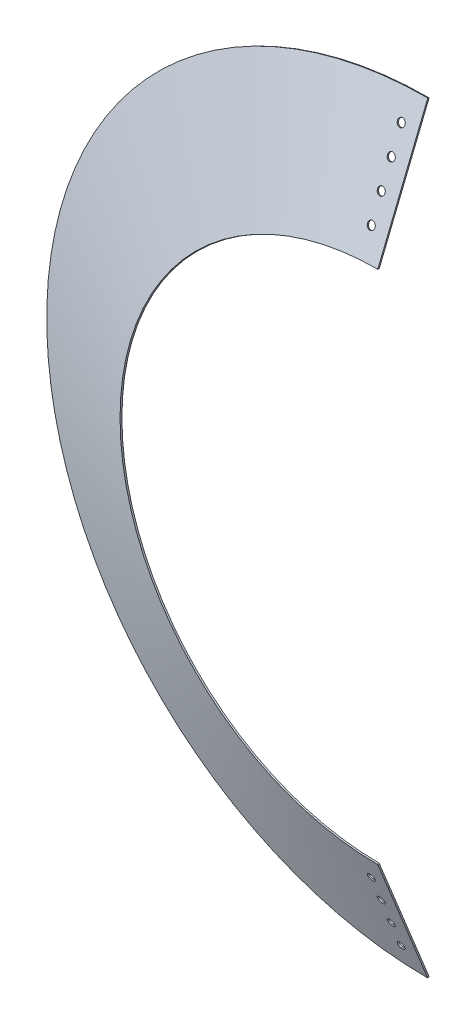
SolidWorks part; units mm, degrees
ref_plane "Plan de face" through (0, 0, 0) normal (0, 0, 1) x (1, 0, 0)
ref_plane "Plan de dessus" through (0, 0, 0) normal (0, 1, 0) x (1, 0, 0)
ref_plane "Plan de droite" through (0, 0, 0) normal (1, 0, 0) x (0, 0, -1)
sketch "Esquisse1" plane through (0, 0, 0) normal (0, 0, 1) x (1, 0, 0)
  arc A0 (0, 798.95) -> (0, -798.95) centre (0, 0) ccw
  dimension "D1" = 798.95
ref_plane "Plan1" through (0, 0, 105) normal (0, 0, 1) x (1, 0, 0)
sketch "Esquisse2" plane through (0, 0, 105) normal (0, 0, 1) x (1, 0, 0)
  arc A0 (0, 540) -> (0, -540) centre (0, 0) ccw
  dimension "D1" = 540
lofted bend "Plis de transition1" thickness 3 parameters "D1"=0
other "Pli libre1" parameters "D1"=1000, "D4"=180, "D5"=1
ref_plane "Plan3" through (0, 112.8127, 278.2175) normal (0, -0.3758, -0.9267) x (-1, 0, 0)
sketch "Esquisse4" plane through (0, 112.8127, 278.2175) normal (0, -0.3758, -0.9267) x (-1, 0, 0)
  line L0 (35, 749.1264) -> (35, 390.8438) construction
  line L1 (0, 460.97) -> (0, 740.3982) construction
  circle A0 centre (35, 684.49) radius 8
  circle A1 centre (35, 516.85) radius 8
  circle A2 centre (35, 572.73) radius 8
  circle A3 centre (35, 628.61) radius 8
  point P15 (8.6771, 726.3985)
  dimension "D2" = 16
  dimension "D3" = 16
  dimension "D4" = 16
  dimension "D5" = 16
  dimension "D1" = 35
  dimension "D6" = 55.88
  dimension "D7" = 111.76
  dimension "D8" = 167.64
  dimension "D9" = 223.52
extrude "Enlèv. mat.-Extru.4" cut sketch "Esquisse4" against normal through all both and the other way through all
ref_plane "Plan4" through (0, -112.8127, 278.2175) normal (0, 0.3758, -0.9267) x (-1, 0, 0)
sketch "Esquisse5" plane through (0, -112.8127, 278.2175) normal (0, 0.3758, -0.9267) x (-1, 0, 0)
  line L0 (35, -755.9037) -> (35, -400.3355) construction
  line L1 (0, -460.97) -> (0, -740.3982) construction
  circle A0 centre (35, -516.8782) radius 8
  circle A1 centre (35, -572.7582) radius 8
  circle A2 centre (35, -628.6382) radius 8
  circle A3 centre (35, -684.5182) radius 8
  dimension "D2" = 16
  dimension "D3" = 16
  dimension "D4" = 16
  dimension "D5" = 16
  dimension "D1" = 35
  dimension "D6" = 55.88
  dimension "D7" = 111.76
  dimension "D8" = 167.64
  dimension "D9" = 223.52
extrude "Enlèv. mat.-Extru.5" cut sketch "Esquisse5" against normal through all both and the other way through all
sketch "Lignes de pliage1" [suppressed] plane through (0, 0, 0) normal (0, 1, 0) x (1, 0, 0)
sketch "Cube de visualisation1" [suppressed] plane through (0, 0, 0) normal (0, 1, 0) x (1, 0, 0)
sheet metal parameters "Tôlerie3" thickness 3 parameters "D1"=1.946
flat pattern "Etat déplié3"
sketch "Lignes de pliage2" plane through (0, 112.8127, 278.2175) normal (0, -0.3758, -0.9267) x (-1, 0, 0)
  line L0 (133.0735, -689.9001) -> (196.8407, -961.9549) construction
  line L3 (0, 460.97) -> (0, 740.3982) construction
sketch3d "Cube de visualisation2" [suppressed]
  line L0 (-31.8836, 858.4456, 0) -> (164.9571, -843.9075, 0) construction
  line L1 (758.4274, 949.8281, 0) -> (955.2681, -752.525, 0) construction
  line L2 (-31.8836, 858.4456, 0) -> (758.4274, 949.8281, 0) construction
  line L3 (164.9571, -843.9075, 0) -> (955.2681, -752.525, 0) construction
other "Dépliage-<Pli libre1>1"
sheet metal parameters "Tôlerie9" thickness 3 parameters "D1"=1.946
flat pattern "Etat déplié3"
sketch "Lignes de pliage2" plane through (0, 112.8127, 278.2175) normal (0, -0.3758, -0.9267) x (-1, 0, 0)
sketch3d "Cube de visualisation2" [suppressed]
  line L0 (-31.8836, 858.4456, 0) -> (164.9571, -843.9075, 0) construction
  line L1 (758.4274, 949.8281, 0) -> (955.2681, -752.525, 0) construction
  line L2 (-31.8836, 858.4456, 0) -> (758.4274, 949.8281, 0) construction
  line L3 (164.9571, -843.9075, 0) -> (955.2681, -752.525, 0) construction
other "Dépliage-<Pli libre1>1"
sheet metal parameters "Tôlerie10" thickness 3 parameters "D1"=1.946
flat pattern "Etat déplié3"
sketch "Lignes de pliage2" plane through (0, 112.8127, 278.2175) normal (0, -0.3758, -0.9267) x (-1, 0, 0)
sketch3d "Cube de visualisation2" [suppressed]
  line L0 (-31.8836, 858.4456, 0) -> (164.9571, -843.9075, 0) construction
  line L1 (758.4274, 949.8281, 0) -> (955.2681, -752.525, 0) construction
  line L2 (-31.8836, 858.4456, 0) -> (758.4274, 949.8281, 0) construction
  line L3 (164.9571, -843.9075, 0) -> (955.2681, -752.525, 0) construction
other "Dépliage-<Pli libre1>1"
